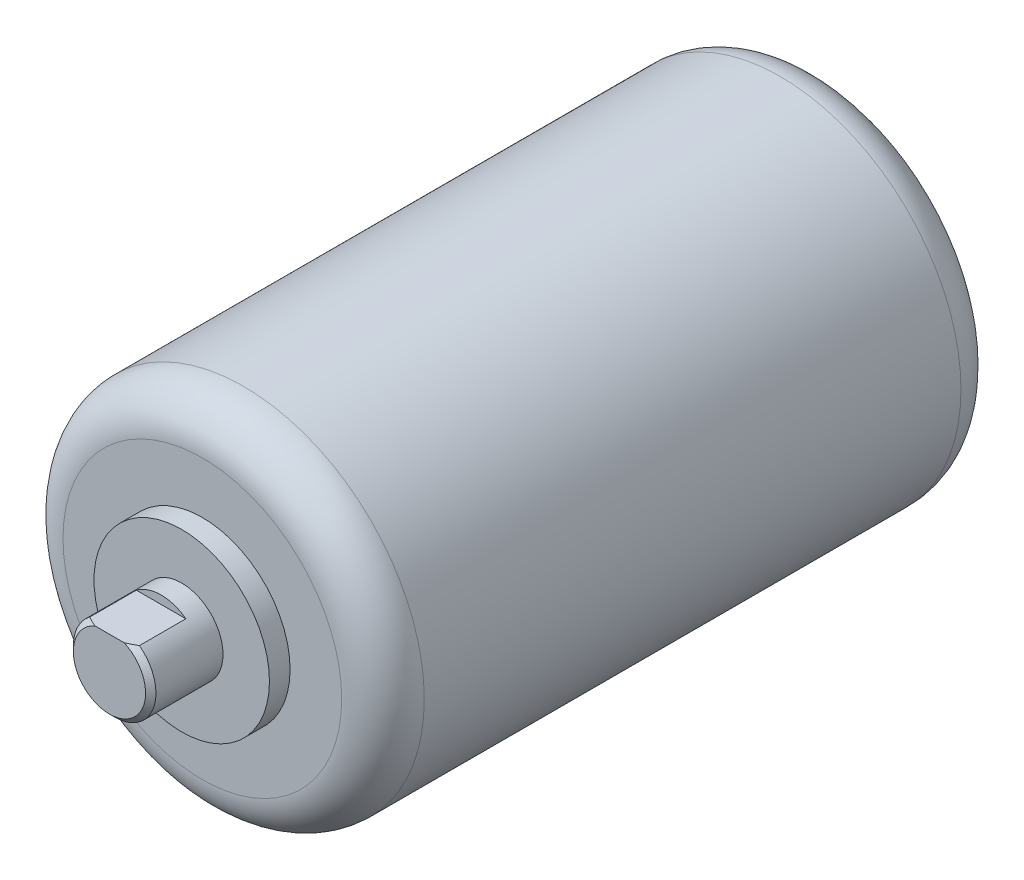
SolidWorks part; units mm, degrees
ref_plane "Plane1" through (0, 0, 0) normal (0, 0, 1) x (1, 0, 0)
ref_plane "Plane2" through (0, 0, 0) normal (0, 1, 0) x (1, 0, 0)
ref_plane "Plane3" through (0, 0, 0) normal (1, 0, 0) x (0, 0, -1)
sketch "Esquisse1" plane through (0, 0, 0) normal (0, 0, 1) x (1, 0, 0)
  circle A0 centre (0, 0) radius 17.5
  dimension "D1" = 35
extrude "Base-Extrusion" add sketch "Esquisse1" along normal blind 60
sketch "Esquisse2" plane through (0, 0, 60) normal (0, 0, 1) x (1, 0, 0)
  circle A0 centre (0, 0) radius 8.5
  dimension "D1" = 17
extrude "Boss.-Extru.1" add sketch "Esquisse2" along normal blind 2
sketch "Esquisse3" plane through (0, 0, 62) normal (0, 0, 1) x (1, 0, 0)
  circle A0 centre (0, 0) radius 4
  dimension "D1" = 8
extrude "Boss.-Extru.2" add sketch "Esquisse3" along normal blind 7
chamfer "Chanfrein1" distance 0.5 angle 45
fillet "Congé1" radius 4
fillet "Congé2" radius 4
sketch "Esquisse4" plane through (0, 0, 69) normal (0, 0, 1) x (1, 0, 0)
  line L0 (-2.4, 3.2) -> (2.4, 3.2)
  line L1 (-2.4, 3.2) -> (-2.4, 4.3595)
  line L2 (-2.4, 4.3595) -> (2.4, 4.3595)
  line L3 (2.4, 4.3595) -> (2.4, 3.2)
  circle A0 centre (0, 0) radius 4 construction
  dimension "D1" = 3.2
extrude "Enlèv. mat.-Extru.1" cut sketch "Esquisse4" against normal blind 5
